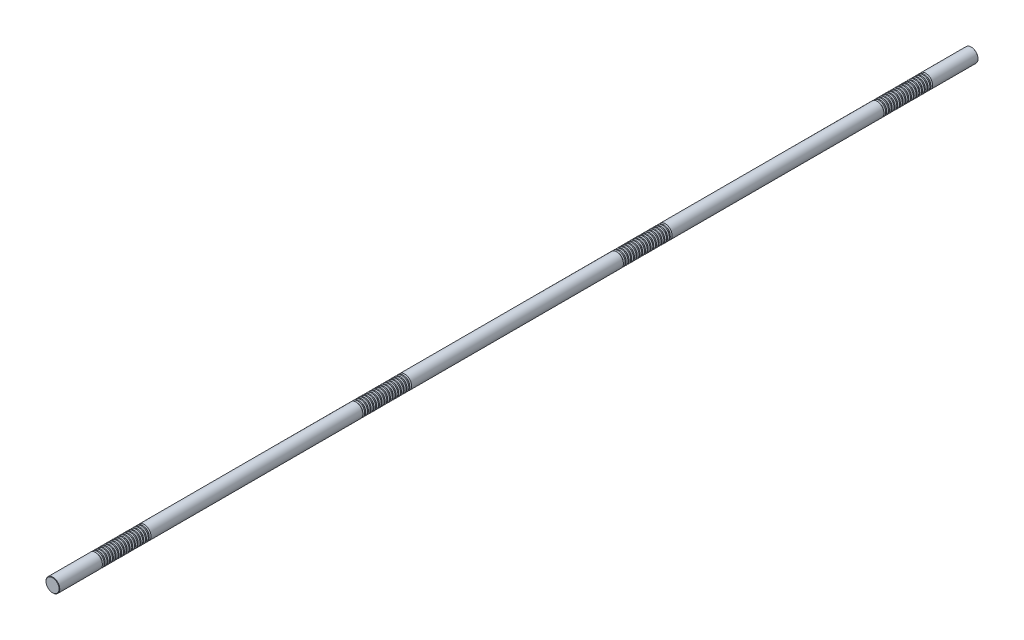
SolidWorks part; units mm, degrees
ref_plane "Front Plane" through (0, 0, 0) normal (0, 0, 1) x (1, 0, 0)
ref_plane "Top Plane" through (0, 0, 0) normal (0, 1, 0) x (1, 0, 0)
ref_plane "Right Plane" through (0, 0, 0) normal (1, 0, 0) x (0, 0, -1)
sketch "Sketch1" plane through (0, 0, 0) normal (0, 0, 1) x (1, 0, 0)
  circle A0 centre (0, 0) radius 15
  dimension "D1" = 30
extrude "Boss-Extrude1" add sketch "Sketch1" along normal mid plane 2000
chamfer "Chamfer1" distance 0.75 angle 45 2 edges at (15, 0, -1000) (15, 0, 1000)
sketch "Sketch2" plane through (0, 0, 0) normal (1, 0, 0) x (0, 0, -1)
  line L0 (900.4689, 15) -> (896.5311, 15)
  line L1 (999.25, 15) -> (-999.25, 15) construction
  line L2 (896.5311, 15) -> (897.4689, 11.5)
  line L3 (897.4689, 11.5) -> (899.5311, 11.5)
  line L4 (899.5311, 11.5) -> (900.4689, 15)
  line L5 (1000, -14.25) -> (1000, 14.25) construction
  point P4 (898.5, 15)
  point P7 (898.5, 11.5)
  point P8 (900, 13.25)
  point P9 (897, 13.25)
  dimension "D1" = 3
  dimension "D2" = 100
  dimension "D3" = 3.5
  dimension "D4" = 30
revolve "Cut-Revolve1" cut sketch "Sketch2" angle 360 about axis through (0, 0, 1000) along (0, 0, -1)
pattern_linear "LPattern1" count 18 spacing 6 along (0, 0, 1) of "Cut-Revolve1"
pattern_linear "LPattern2" count 4 spacing 567 along (0, 0, 1) of "Cut-Revolve1", "LPattern1"
